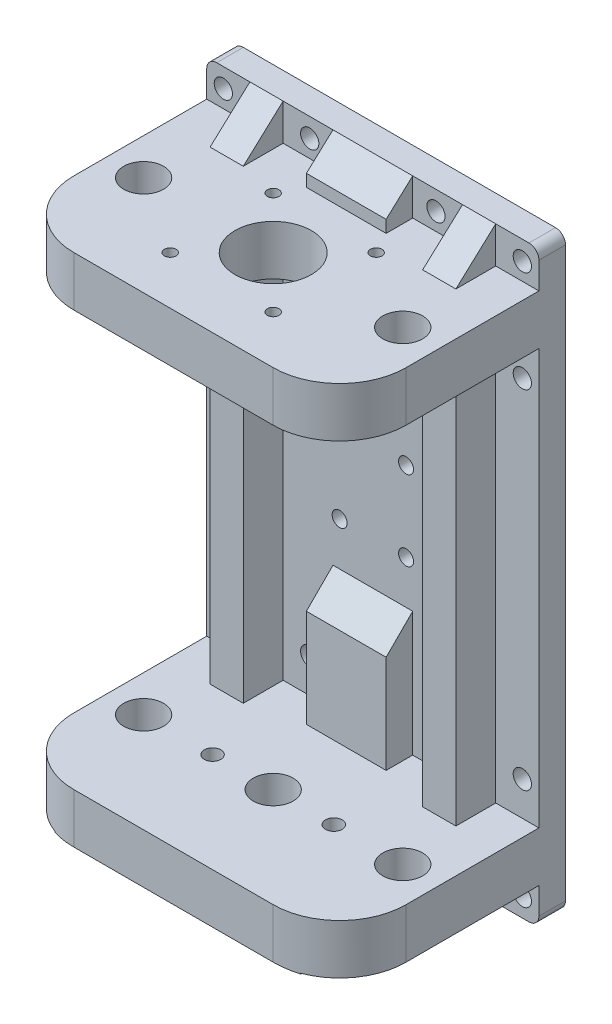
SolidWorks part; units mm, degrees
ref_plane "Alzado" through (0, 0, 0) normal (0, 0, 1) x (1, 0, 0)
ref_plane "Planta" through (0, 0, 0) normal (0, 1, 0) x (1, 0, 0)
ref_plane "Vista lateral" through (0, 0, 0) normal (1, 0, 0) x (0, 0, -1)
sketch "Croquis1" plane through (0, 0, 0) normal (0, 0, 1) x (1, 0, 0)
  line L1 (-643.0531, 343.749) -> (-543.0531, 343.749)
  line L2 (-643.0531, 343.749) -> (-643.0531, 166.749)
  line L3 (-643.0531, 166.749) -> (-543.0531, 166.749)
  line L4 (-543.0531, 343.749) -> (-543.0531, 166.749)
  circle A0 centre (-638.0531, 337.999) radius 2.75
  circle A1 centre (-612.0531, 337.999) radius 2.75
  circle A2 centre (-638.0531, 307.499) radius 2.75
  circle A3 centre (-612.0531, 307.499) radius 2.75
  circle A4 centre (-574.0531, 337.999) radius 2.75
  circle A5 centre (-548.0531, 337.999) radius 2.75
  circle A6 centre (-548.0531, 307.499) radius 2.75
  circle A7 centre (-574.0531, 307.499) radius 2.75
  circle A8 centre (-603.0531, 267.2999) radius 2.25
  circle A9 centre (-583.0531, 267.2999) radius 2.25
  circle A10 centre (-603.0531, 243.2999) radius 2.25
  circle A11 centre (-583.0531, 243.2999) radius 2.25
  circle A12 centre (-638.0531, 202.999) radius 2.75
  circle A13 centre (-612.0531, 202.999) radius 2.75
  circle A14 centre (-574.0531, 202.999) radius 2.75
  circle A15 centre (-548.0531, 202.999) radius 2.75
  circle A16 centre (-638.0531, 172.499) radius 2.75
  circle A17 centre (-612.0531, 172.499) radius 2.75
  circle A18 centre (-574.0531, 172.499) radius 2.75
  circle A19 centre (-548.0531, 172.499) radius 2.75
  dimension "D3" = 5.5
  dimension "D4" = 4.5
  dimension "D1" = 177
  dimension "D2" = 100
extrude "Saliente-Extruir1" add sketch "Croquis1" along normal blind 8
sketch "Croquis2" plane through (0, 0, 8) normal (0, 0, 1) x (1, 0, 0)
  line L0 (-643.0531, 343.749) -> (-643.0531, 166.749) construction
  line L1 (-643.0531, 332.749) -> (-543.0531, 332.749)
  line L2 (-643.0531, 332.749) -> (-643.0531, 317.749)
  line L3 (-643.0531, 317.749) -> (-543.0531, 317.749)
  line L4 (-543.0531, 332.749) -> (-543.0531, 317.749)
  line L5 (-543.0531, 166.749) -> (-543.0531, 343.749) construction
  line L6 (-543.0531, 343.749) -> (-643.0531, 343.749) construction
  line L7 (-643.0531, 192.749) -> (-543.0531, 192.749)
  line L8 (-643.0531, 192.749) -> (-643.0531, 177.749)
  line L9 (-643.0531, 177.749) -> (-543.0531, 177.749)
  line L10 (-543.0531, 192.749) -> (-543.0531, 177.749)
  line L11 (-643.0531, 166.749) -> (-543.0531, 166.749) construction
  dimension "D1" = 11
  dimension "D2" = 11
  dimension "D3" = 15
  dimension "D4" = 15
extrude "Saliente-Extruir2" add sketch "Croquis2" along normal blind 60
sketch "Croquis3" plane through (0, 332.749, 0) normal (0, 1, 0) x (1, 0, 0)
  line L0 (-543.0531, -38) -> (-643.0531, -38) construction
  line L1 (-543.0531, -68) -> (-543.0531, -8) construction
  line L2 (-643.0531, -68) -> (-643.0531, -8) construction
  circle A0 centre (-593.0531, -38) radius 11.5
  circle A1 centre (-554.0531, -38) radius 6
  circle A2 centre (-632.0531, -38) radius 6
  dimension "D1" = 12
  dimension "D2" = 12
  dimension "D3" = 23
  dimension "D4" = 11
  dimension "D5" = 11
extrude "Cortar-Extruir1" cut sketch "Croquis3" against normal blind 20
sketch "Croquis4" plane through (0, 192.749, 0) normal (0, 1, 0) x (1, 0, 0)
  line L0 (-643.0531, -38) -> (-543.0531, -38) construction
  line L1 (-643.0531, -68) -> (-643.0531, -8) construction
  line L2 (-543.0531, -68) -> (-543.0531, -8) construction
  circle A0 centre (-554.0531, -38) radius 6
  circle A1 centre (-632.0531, -38) radius 6
  circle A2 centre (-593.0531, -38) radius 5
  dimension "D1" = 12
  dimension "D2" = 12
  dimension "D5" = 10
  dimension "D3" = 11
  dimension "D4" = 11
extrude "Cortar-Extruir2" cut sketch "Croquis4" against normal blind 10
sketch "Croquis5" plane through (0, 192.749, 0) normal (0, 1, 0) x (1, 0, 0)
  circle A0 centre (-574.8031, -38) radius 2.5
  circle A1 centre (-611.3031, -38) radius 2.5
  circle A2 centre (-593.0531, -38) radius 6
  dimension "D1" = 12
extrude "Cortar-Extruir3" cut sketch "Croquis5" against normal blind 20
sketch "Croquis6" plane through (0, 177.749, 0) normal (0, -1, 0) x (1, 0, 0)
  line L1 (-617.3653, 38) -> (-614.3342, 32.75)
  line L2 (-614.3342, 32.75) -> (-608.272, 32.75)
  line L3 (-608.272, 32.75) -> (-605.241, 38)
  line L4 (-605.241, 38) -> (-608.272, 43.25)
  line L5 (-608.272, 43.25) -> (-614.3342, 43.25)
  line L6 (-614.3342, 43.25) -> (-617.3653, 38)
  line L7 (-580.8653, 38) -> (-577.8342, 32.75)
  line L8 (-577.8342, 32.75) -> (-571.772, 32.75)
  line L9 (-571.772, 32.75) -> (-568.741, 38)
  line L10 (-568.741, 38) -> (-571.772, 43.25)
  line L11 (-571.772, 43.25) -> (-577.8342, 43.25)
  line L12 (-577.8342, 43.25) -> (-580.8653, 38)
  circle A0 centre (-611.3031, 38) radius 5.25 construction
  circle A1 centre (-574.8031, 38) radius 5.25 construction
  dimension "D1" = 10.5
  dimension "D2" = 10.5
extrude "Cortar-Extruir4" cut sketch "Croquis6" against normal blind 6
fillet "Redondeo2" radius 20 4 edges at (-643.0531, 185.249, 68) (-543.0531, 185.249, 68) (-543.0531, 325.249, 68) (-643.0531, 325.249, 68)
sketch "Croquis8" plane through (0, 343.749, 0) normal (0, 1, 0) x (1, 0, 0)
  line L0 (-543.0531, -8) -> (-643.0531, -8) construction
  line L1 (-581.0531, -8) -> (-605.0531, -8)
  line L2 (-581.0531, -8) -> (-581.0531, -16)
  line L3 (-581.0531, -16) -> (-605.0531, -16)
  line L4 (-605.0531, -8) -> (-605.0531, -16)
  line L5 (-543.0531, -8) -> (-643.0531, -8) construction
  line L6 (-620.0531, -8) -> (-630.0531, -8)
  line L7 (-620.0531, -8) -> (-620.0531, -20)
  line L8 (-620.0531, -20) -> (-630.0531, -20)
  line L9 (-630.0531, -8) -> (-630.0531, -20)
  line L11 (-556.0531, -8) -> (-566.0531, -8)
  line L12 (-556.0531, -8) -> (-556.0531, -20)
  line L13 (-556.0531, -20) -> (-566.0531, -20)
  line L14 (-566.0531, -8) -> (-566.0531, -20)
  point P16 (-593.0531, -8)
  dimension "D1" = 13
  dimension "D2" = 10
  dimension "D3" = 12
  dimension "D4" = 50
  dimension "D5" = 13
  dimension "D6" = 10
  dimension "D7" = 12
  dimension "D8" = 8
  dimension "D9" = 12
extrude "Saliente-Extruir4" add sketch "Croquis8" against normal up to surface (177 mm away)
sketch "Croquis9" plane through (-630.0531, 0, 0) normal (-1, 0, 0) x (0, 0, 1)
  line L0 (8, 343.749) -> (20, 332.749)
  line L1 (20, 332.749) -> (20, 343.749)
  line L2 (20, 343.749) -> (8, 343.749)
extrude "Cortar-Extruir5" cut sketch "Croquis9" against normal through all both and the other way through all
sketch "Croquis10" plane through (-605.0531, 0, 0) normal (-1, 0, 0) x (0, 0, 1)
  line L0 (20, 255.249) -> (0, 255.249) construction
  line L1 (20, 192.749) -> (20, 317.749) construction
  line L2 (0, 343.749) -> (0, 166.749) construction
  line L3 (20, 292.249) -> (8, 280.249)
  line L4 (8, 192.749) -> (8, 317.749) construction
  line L5 (8, 280.249) -> (8, 230.249)
  line L6 (8, 317.749) -> (8, 192.749) construction
  line L7 (20, 292.249) -> (20, 218.249)
  line L8 (20, 218.249) -> (8, 230.249)
  point P15 (8, 255.249)
  dimension "D1" = 45
  dimension "D2" = 25
extrude "Cortar-Extruir6" cut sketch "Croquis10" against normal up to surface (24 mm away)
sketch "Croquis11" plane through (0, 177.749, 0) normal (0, -1, 0) x (1, 0, 0)
  line L0 (-623.0531, 68) -> (-563.0531, 68) construction
  line L1 (-623.0531, 68) -> (-620.0531, 68)
  line L2 (-630.0531, 20) -> (-620.0531, 20)
  line L3 (-620.0531, 20) -> (-620.0531, 68)
  line L4 (-566.0531, 20) -> (-556.0531, 20)
  line L5 (-556.0531, 20) -> (-556.0531, 66.735)
  line L6 (-566.0531, 20) -> (-566.0531, 68)
  line L7 (-630.0531, 20) -> (-630.0531, 66.735)
  line L8 (-566.0531, 68) -> (-563.0531, 68)
  arc A0 (-543.0531, 48) -> (-563.0531, 68) centre (-563.0531, 48) ccw construction
  arc A1 (-623.0531, 68) -> (-643.0531, 48) centre (-623.0531, 48) ccw construction
  arc A2 (-556.0531, 66.735) -> (-563.0531, 68) centre (-563.0531, 48) ccw
  arc A3 (-623.0531, 68) -> (-630.0531, 66.735) centre (-623.0531, 48) ccw
extrude "Saliente-Extruir5" add sketch "Croquis11" along normal up to surface (11 mm away)
sketch "Croquis12" plane through (-630.0531, 0, 0) normal (-1, 0, 0) x (0, 0, 1)
  line L0 (8, 166.749) -> (68, 177.749)
  line L1 (68, 177.749) -> (68, 166.749)
  line L2 (68, 166.749) -> (8, 166.749)
extrude "Cortar-Extruir7" cut sketch "Croquis12" against normal through all both and the other way through all
fillet "Redondeo3" radius 3 4 edges at (-543.0531, 166.749, 4) (-643.0531, 166.749, 4) (-543.0531, 343.749, 4) (-643.0531, 343.749, 4)
sketch "Croquis13" plane through (0, 332.749, 0) normal (0, 1, 0) x (1, 0, 0)
  circle A0 centre (-577.5531, -53.5) radius 1.75
  circle A1 centre (-577.5531, -22.5) radius 1.75
  circle A2 centre (-608.5531, -53.5) radius 1.75
  circle A3 centre (-608.5531, -22.5) radius 1.75
extrude "Cortar-Extruir8" cut sketch "Croquis13" against normal blind 15
sketch "Croquis14" plane through (0, 317.749, 0) normal (0, -1, 0) x (1, 0, 0)
  circle A0 centre (-608.5531, 22.5) radius 3.5
  circle A1 centre (-608.5531, 53.5) radius 3.5
  circle A2 centre (-577.5531, 53.5) radius 3.5
  circle A3 centre (-577.5531, 22.5) radius 3.5
  dimension "D1" = 7
extrude "Cortar-Extruir9" cut sketch "Croquis14" against normal blind 10
